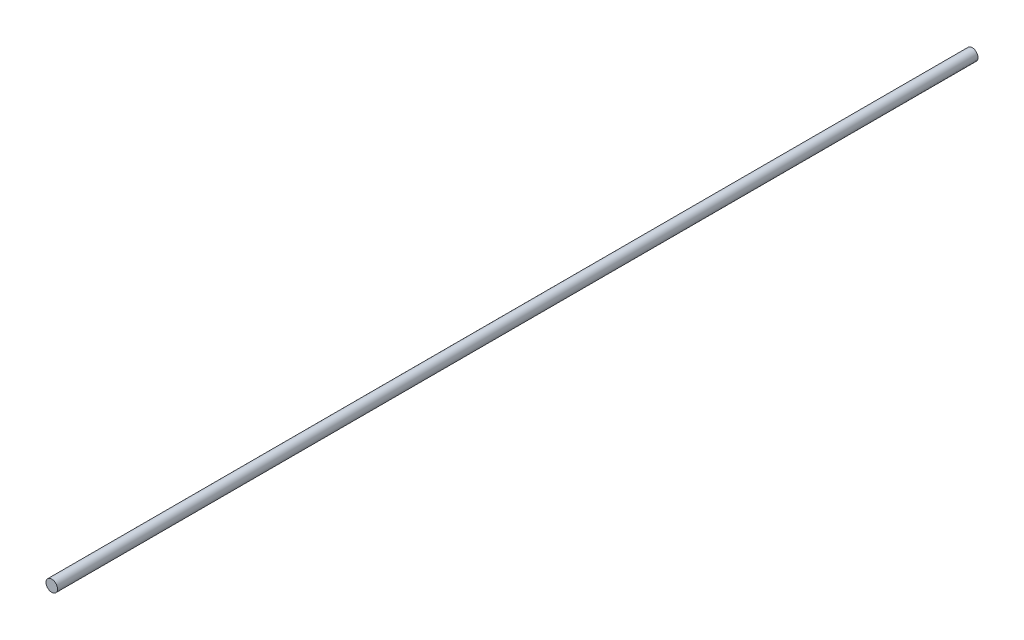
SolidWorks part; units mm, degrees
ref_plane "Front Plane" through (0, 0, 0) normal (0, 0, 1) x (1, 0, 0)
ref_plane "Top Plane" through (0, 0, 0) normal (0, 1, 0) x (1, 0, 0)
ref_plane "Right Plane" through (0, 0, 0) normal (1, 0, 0) x (0, 0, -1)
sketch "Sketch1" plane through (0, 0, 0) normal (0, 0, 1) x (1, 0, 0)
  circle A0 centre (0, 0) radius 30
  dimension "D1" = 60
extrude "Boss-Extrude1" add sketch "Sketch1" against normal blind 4800
